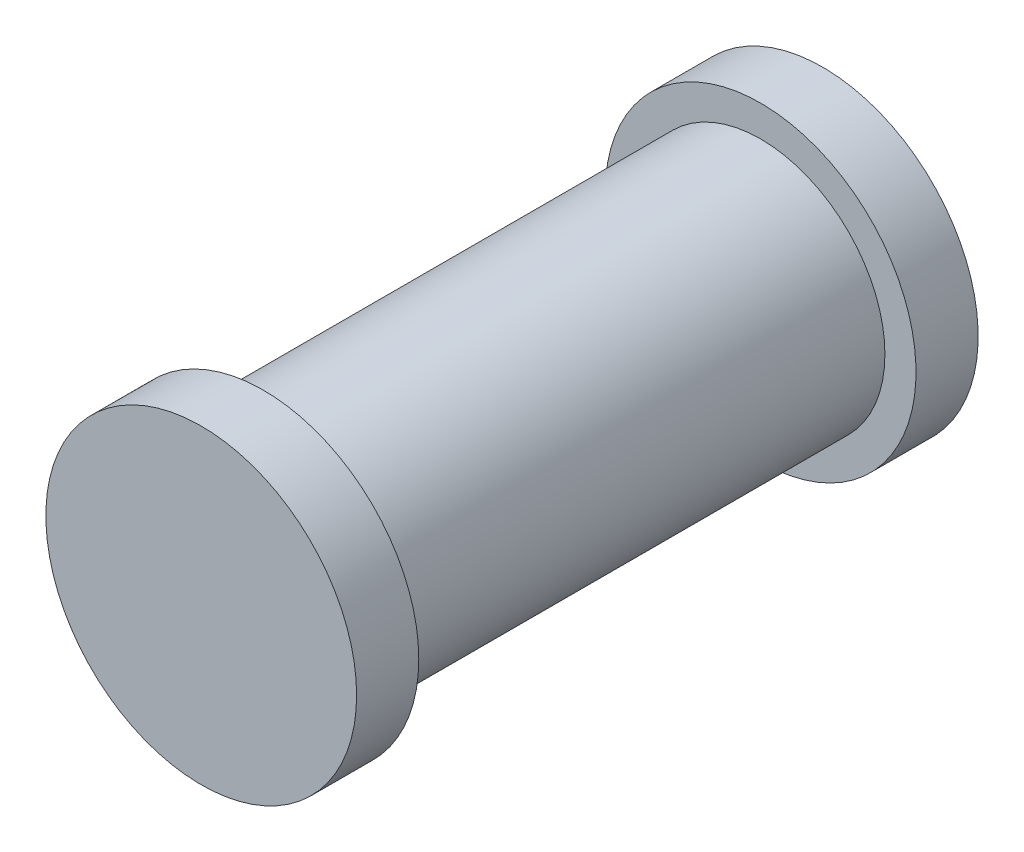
SolidWorks part; units mm, degrees
ref_plane "Front Plane" through (0, 0, 0) normal (0, 0, 1) x (1, 0, 0)
ref_plane "Top Plane" through (0, 0, 0) normal (0, 1, 0) x (1, 0, 0)
ref_plane "Right Plane" through (0, 0, 0) normal (1, 0, 0) x (0, 0, -1)
sketch "Sketch1" plane through (0, 0, 0) normal (0, 0, 1) x (1, 0, 0)
  circle A0 centre (0, 0) radius 6.35
  circle A1 centre (0, 0) radius 6.35 construction
  dimension "D1" = 12.7
extrude "Extrude1" add sketch "Sketch1" against normal up to surface (25.4 mm away)
sketch "Sketch2" plane through (0, 0, 0) normal (0, 0, 1) x (1, 0, 0)
  circle A0 centre (0, 0) radius 7.9375
  dimension "D1" = 15.875
extrude "Extrude2" add sketch "Sketch2" along normal blind 3.175
sketch "Sketch3" plane through (0, 0, -25.4) normal (0, 0, -1) x (-1, 0, 0)
  circle A0 centre (0, 0) radius 7.9375
  circle A1 centre (0, 0) radius 7.9375 construction
extrude "Extrude3" add sketch "Sketch3" along normal blind 3.175
